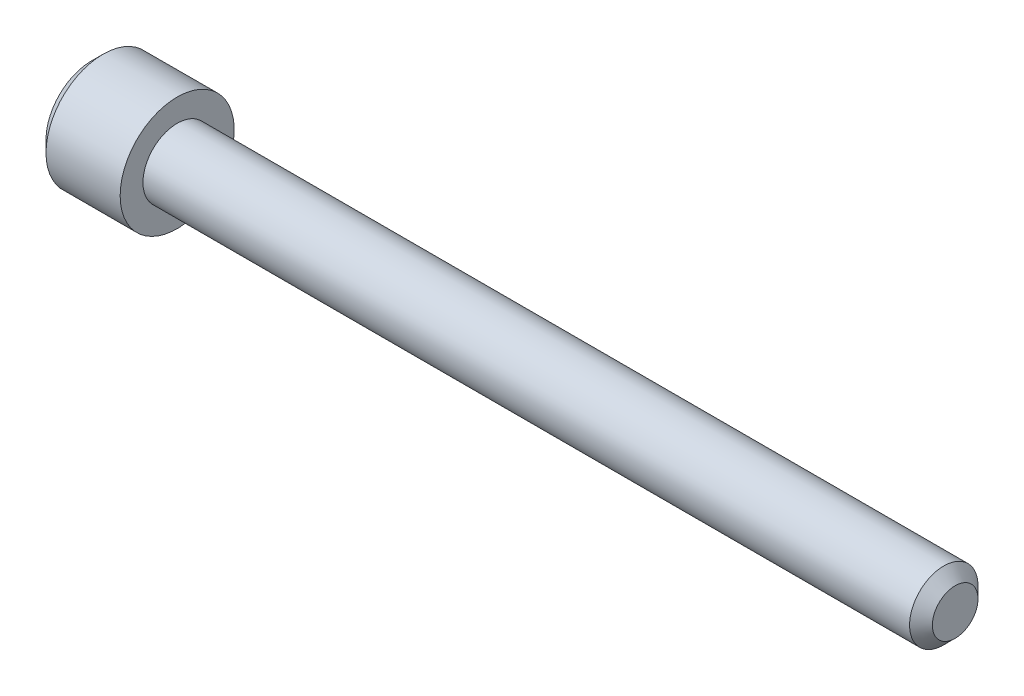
SolidWorks part; units mm, degrees
ref_plane "Face" through (0, 0, 0) normal (0, 0, 1) x (1, 0, 0)
ref_plane "Dessus" through (0, 0, 0) normal (0, 1, 0) x (1, 0, 0)
ref_plane "Droite" through (0, 0, 0) normal (1, 0, 0) x (0, 0, -1)
sketch "Esquisse1" plane through (0, 0, 0) normal (0, 0, 1) x (1, 0, 0)
  line L0 (0, 0) -> (0, 2.5)
  line L1 (0, 2.5) -> (1, 2.5)
  line L2 (1, 2.5) -> (1, 5)
  line L3 (1, 5) -> (8.5, 5)
  line L4 (8.5, 5) -> (8.5, 3)
  line L5 (8.5, 3) -> (76.7, 3)
  line L6 (76.7, 3) -> (76.7, 0)
  line L7 (76.7, 0) -> (0, 0)
  line L8 (-3.7394, 0) -> (85.9789, 0) construction
  dimension "D1" = 3
  dimension "D2" = 2.5
  dimension "D3" = 5
  dimension "D4" = 7.5
  dimension "D5" = 1
  dimension "D6" = 68.2
revolve "Révolution1" add sketch "Esquisse1" angle 360 about L8
chamfer "Chanfrein1" distance 1 angle 45
chamfer "Chanfrein2" distance 1 angle 45
